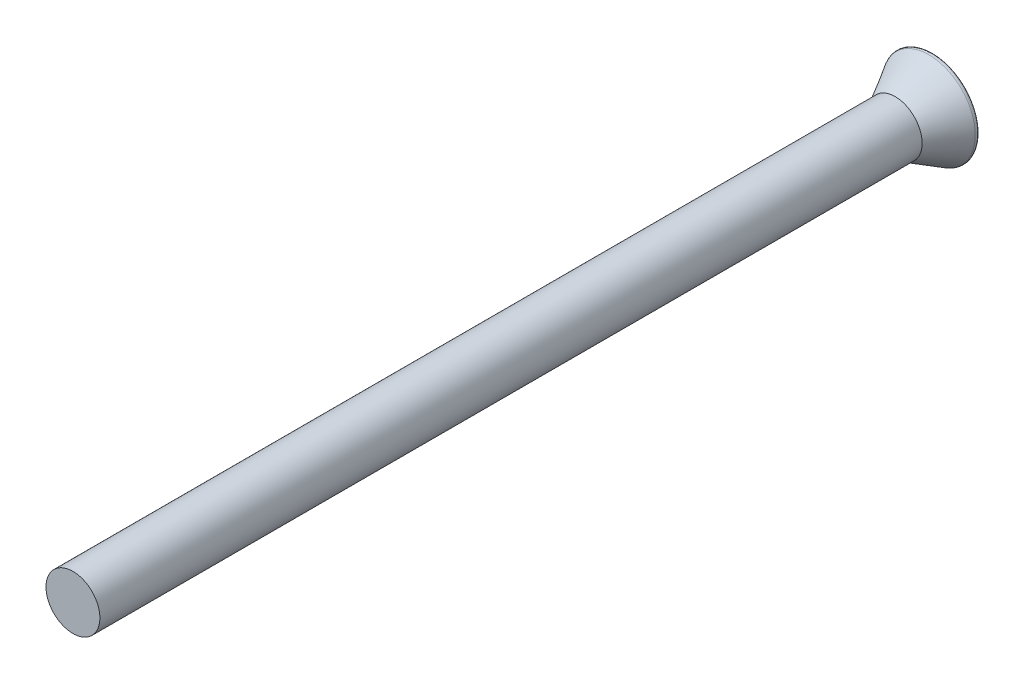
SolidWorks part; units mm, degrees
ref_plane "Front" through (0, 0, 0) normal (0, 0, 1) x (1, 0, 0)
ref_plane "Top" through (0, 0, 0) normal (0, 1, 0) x (1, 0, 0)
ref_plane "Right" through (0, 0, 0) normal (1, 0, 0) x (0, 0, -1)
sketch "Logo3_Revol_Axis" plane through (0, 0, 0) normal (0, 1, 0) x (1, 0, 0)
  line L0 (0, -43.5172) -> (0, 43.5172) construction
sketch "Logo3_bib1" plane through (0, 0, 0) normal (0, -1, 0) x (-1, 0, 0)
  line L0 (2.0554, -0.1791) -> (1.1938, -1.6713)
  line L1 (0, 0) -> (0, -38.1)
  line L2 (0, -43.5172) -> (0, 43.5172) construction
  line L3 (0, 0) -> (1.952, 0)
  line L6 (0, -1.6713) -> (1.1938, -1.6713) construction
  line L7 (0, -38.1) -> (1.1938, -38.1)
  line L8 (1.1938, -1.6713) -> (1.1938, -38.1)
  line L10 (0, 16.5468) -> (0, -90.6614) construction
  arc A0 (1.952, 0) -> (2.0554, -0.1791) centre (1.952, -0.1194) cw
revolve "Revolve1" add sketch "Logo3_bib1" angle 360 about L10
sketch "Logo3_bib2" [suppressed] plane through (0, 0, 0) normal (0, 1, 0) x (1, 0, 0)
  line L0 (0, 0) -> (0, -80) construction
  line L1 (0, -30) -> (-1.5, -30)
  line L2 (-1.5, -30) -> (-1.5, -24)
  line L3 (0, 0) -> (-5.5496, 0)
  line L4 (-1.5, -24) -> (-3.5, -18.505) construction
  line L6 (-5.6795, -0.225) -> (-3.5, -4)
  line L7 (0, 0) -> (0, -30)
  line L8 (0, -4) -> (-6.3981, -4) construction
  line L12 (-3.5, -4) -> (-3.5, -18.505)
  arc A0 (-1.5, -24) -> (-3.5, -18.505) centre (-10.0486, -24) ccw
  arc A1 (-5.5496, 0) -> (-5.6795, -0.225) centre (-5.5496, -0.15) ccw
revolve "Revolve_shoulder" [suppressed] add sketch "Logo3_bib2" angle 360 about L0
equation "\"D2@Logo3_bib2\" = \"logo3_punch_d@Logo3_bib2\"/20"
equation "\"D1@Logo3_bib1\" = \"logo3_d1@Logo3_bib1\"/20"
